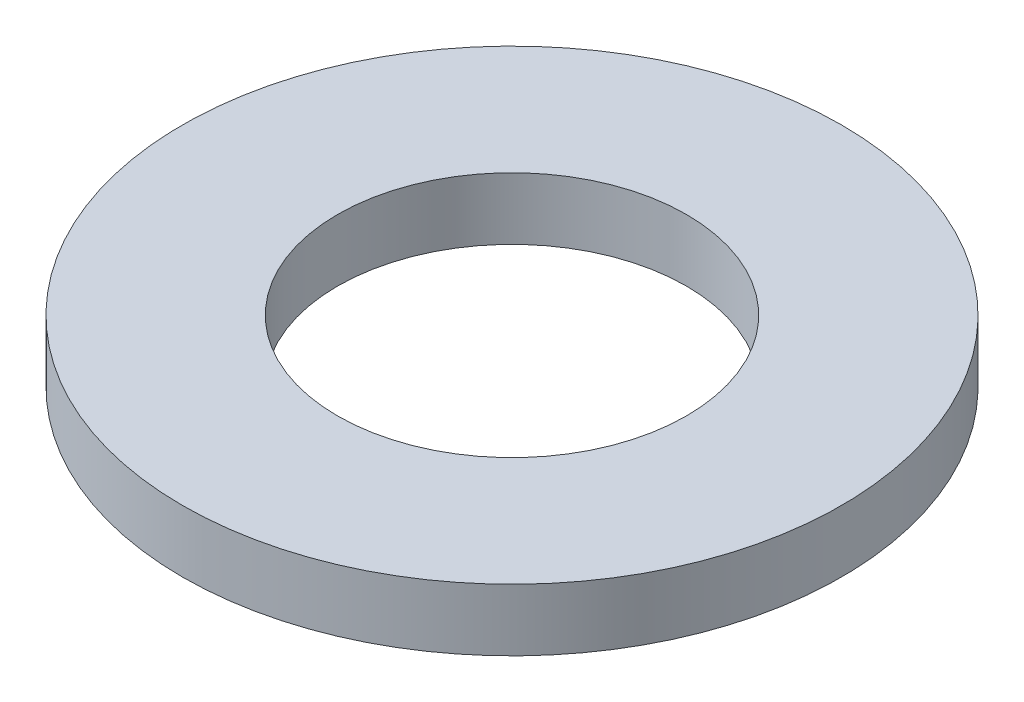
SolidWorks part; units mm, degrees
ref_plane "Front Plane" through (0, 0, 0) normal (0, 0, 1) x (1, 0, 0)
ref_plane "Top Plane" through (0, 0, 0) normal (0, 1, 0) x (1, 0, 0)
ref_plane "Right Plane" through (0, 0, 0) normal (1, 0, 0) x (0, 0, -1)
other "Configuration Table"
sketch "BodySke" plane through (0, 0, 0) normal (0, 0, -1) x (1, 0, 0)
  line L0 (0, 0) -> (0, 7.8986) construction
  line L2 (4.5, 1.6) -> (8.5, 1.6)
  line L3 (4.5, 1.6) -> (4.5, 0)
  line L4 (4.5, 0) -> (8.5, 0)
  line L5 (8.5, 1.6) -> (8.5, 0)
  dimension "Inner_dia" = 9
  dimension "Outer_dia" = 17
  dimension "Thickness" = 1.6
revolve "BaseBody" add sketch "BodySke" angle 360 about L0
